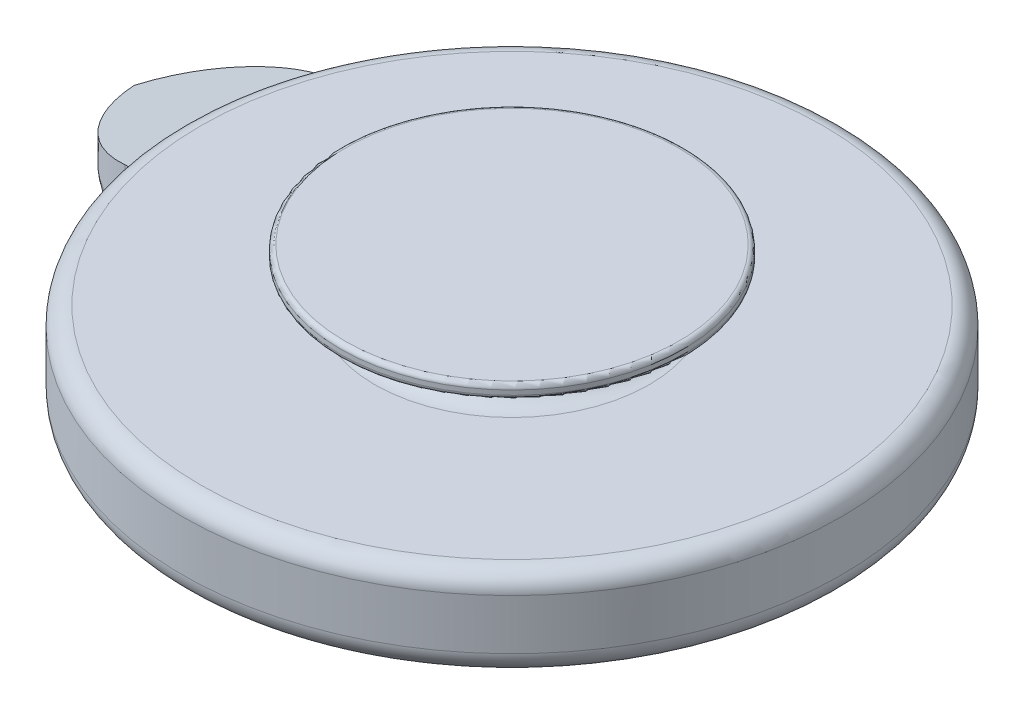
SolidWorks part; units mm, degrees
ref_plane "Front Plane" through (0, 0, 0) normal (0, 0, 1) x (1, 0, 0)
ref_plane "Top Plane" through (0, 0, 0) normal (0, 1, 0) x (1, 0, 0)
ref_plane "Right Plane" through (0, 0, 0) normal (1, 0, 0) x (0, 0, -1)
sketch "Sketch1" plane through (0, 0, 0) normal (0, 1, 0) x (1, 0, 0)
  circle A0 centre (0, 0) radius 72
  dimension "D1" = 144
extrude "Boss-Extrude1" add sketch "Sketch1" along normal blind 20
sketch "Sketch3" plane through (0, 20, 0) normal (0, 1, 0) x (1, 0, 0)
  circle A0 centre (0, 0) radius 25
  dimension "D1" = 50
extrude "Boss-Extrude2" add sketch "Sketch3" along normal blind 10
sketch "Sketch4" plane through (0, 30, 0) normal (0, 1, 0) x (1, 0, 0)
  circle A0 centre (0, 0) radius 37.5
  dimension "D1" = 75
extrude "Boss-Extrude3" add sketch "Sketch4" along normal mid plane 3
fillet "Fillet2" radius 1 2 edges at (0, 28.5, 37.5) (0, 31.5, 37.5)
fillet "Fillet4" radius 5 1 edges at (0, 20, 25)
sketch "Sketch8" plane through (0, 0, 0) normal (0, 1, 0) x (1, 0, 0)
  line L0 (-67.2102, 28.4919) -> (-65.9549, 28.8782)
  line L1 (-72.1442, -11.145) -> (-70.9536, -12.2305)
  arc A0 (-68.1258, 29.2992) -> (-64.4961, 32.004) centre (-68.975, 34.2265) ccw construction
  arc A1 (-70.374, -15.2153) -> (-73.2298, -11.7031) centre (-75.261, -16.2719) ccw construction
  arc A2 (-68.1258, 29.2992) -> (-64.4961, 32.004) centre (-68.975, 34.2265) ccw construction
  arc A3 (-70.374, -15.2153) -> (-73.2298, -11.7031) centre (-75.261, -16.2719) ccw construction
  circle A4 centre (0, 0) radius 72 construction
  arc A5 (-65.9549, 28.8782) -> (-70.9536, -12.2305) centre (0, 0) ccw
  arc A6 (-72.1442, -11.145) -> (-72.8235, -10.7894) centre (-75.261, -16.2719) ccw
  arc A7 (-67.2102, 28.4919) -> (-72.1442, -11.145) centre (0, 0) ccw construction
  arc A8 (-67.9559, 28.3137) -> (-67.2102, 28.4919) centre (-68.975, 34.2265) ccw
  arc A10 (-64.4961, 32.004) -> (-70.374, -15.2153) centre (0, 0) ccw construction
  ellipse E0 centre (-70.9898, 2.2911) end of major axis (-67.6545, 29.0843) minor radius 26.08 (-69.291, 29.234) -> (-95.3075, 11.8639) ccw construction
  ellipse E1 centre (-69.385, 15.1829) end of major axis (-72.7202, -11.6103) minor radius 26.08 (-95.3075, 11.8639) -> (-74.3435, -11.3543) ccw construction
  ellipse E2 centre (-70.9898, 2.2911) end of major axis (-67.6545, 29.0843) minor radius 26.08 (-69.291, 29.234) -> (-95.3075, 11.8639) ccw construction
  ellipse E3 centre (-69.385, 15.1829) end of major axis (-66.0498, 41.9761) minor radius 26.08 (-95.3075, 11.8639) -> (-74.3435, -11.3543) ccw construction
  spline S0 degree 3 poles (-452.2187, -1974.8309) (469.4366, 2181.5226) (-676.2214, -2267.5189) (262.0349, 1957.9377) knots -77.343111 -77.343111 -77.343111 -77.343111 115.161152 115.161152 115.161152 115.161152 only from (-73.2298, -11.7031) to (-74.3435, -11.3543) construction
  spline S1 degree 3 poles (-249.1802, -1950.2445) (-393.712, 4217.2434) (60.6814, -3199.2584) (-42.407, 2028.2685) knots -228.707558 -228.707558 -228.707558 -228.707558 98.465266 98.465266 98.465266 98.465266 only from (-69.291, 29.234) to (-68.1258, 29.2992) construction
  spline S2 degree 3 poles (-73.2298, -11.7031) (-73.5904, -11.5428) (-73.9619, -11.4273) (-74.3435, -11.3543) knots 0 0 0 0 1 1 1 1 construction
  spline S3 degree 3 poles (-69.291, 29.234) (-68.9006, 29.2111) (-68.5122, 29.2326) (-68.1258, 29.2992) knots 0 0 0 0 1 1 1 1 construction
  spline S4 degree 1 poles (-94.2861, 11.7368) (-74.1555, -10.3721) knots 0 0 1 1 construction
  spline S5 degree 1 poles (-72.8235, -10.7894) (-74.1555, -10.3721) knots 0 0 1 1 construction
  spline S6 degree 1 poles (-69.3496, 28.2357) (-67.9559, 28.3137) knots 0 0 1 1 construction
  spline S7 degree 1 poles (-69.3496, 28.2357) (-94.2861, 11.7368) knots 0 0 1 1 construction
  spline S8 degree 3 poles (-94.2861, 11.7368) (-94.1237, 10.3913) (-93.592, 7.7168) (-91.7367, 2.6267) (-88.0082, -3.0392) (-81.7232, -8.0499) (-76.7238, -9.8806) (-74.1555, -10.3721) knots 1.822986 1.822986 1.822986 1.822986 1.979934 2.136883 2.45078 2.764677 3.078574 3.078574 3.078574 3.078574
  spline S9 degree 3 poles (-74.1555, -10.3721) (-73.6985, -10.4595) (-73.2487, -10.6003) (-72.8235, -10.7894) knots 0 0 0 0 1 1 1 1
  spline S10 degree 3 poles (-67.9559, 28.3137) (-68.4144, 28.2347) (-68.8851, 28.2085) (-69.3496, 28.2357) knots 0 0 0 0 1 1 1 1
  spline S11 degree 3 poles (-69.3496, 28.2357) (-71.96, 28.3889) (-77.2557, 27.8397) (-84.5773, 24.5228) (-89.581, 19.9439) (-92.6276, 15.464) (-93.7988, 13.0014) (-94.2861, 11.7368) knots 0.063019 0.063019 0.063019 0.063019 0.376916 0.690813 1.00471 1.161659 1.318607 1.318607 1.318607 1.318607
  dimension "D1" = 1
extrude "Boss-Extrude5" add sketch "Sketch8" along normal up to surface (15.0778 mm away)
fillet "Fillet5" radius 5 9 edges at (-66.5825, 0, -28.6851) (-67.5802, 0, -28.3909) (-72.4782, 0, 10.9563) (-71.5489, 0, 11.6878) (71.4735, 0, 8.691)
fillet "Fillet6" radius 4 1 edges at (0, 20, 72)
